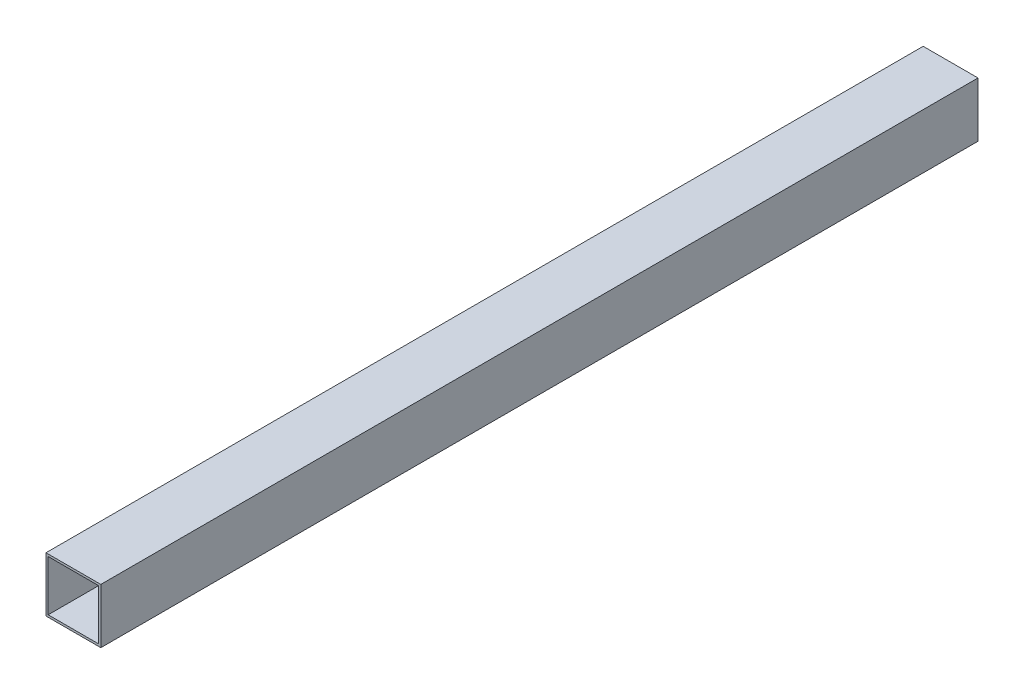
SolidWorks part; units mm, degrees
ref_plane "Piano frontale" through (0, 0, 0) normal (0, 0, 1) x (1, 0, 0)
ref_plane "Piano superiore" through (0, 0, 0) normal (0, 1, 0) x (1, 0, 0)
ref_plane "Piano destro" through (0, 0, 0) normal (1, 0, 0) x (0, 0, -1)
sketch "Schizzo1" plane through (0, 0, 0) normal (0, 0, 1) x (1, 0, 0)
  line L1 (-25, -25) -> (25, -25)
  line L2 (-25, -25) -> (-25, 25)
  line L3 (-25, 25) -> (25, 25)
  line L4 (25, -25) -> (25, 25)
  line L5 (-25, -25) -> (25, 25) construction
  line L6 (-25, 25) -> (25, -25) construction
  point P0 (0, 0)
  dimension "D1" = 50
  dimension "D2" = 50
extrude "Estrusione-Sottile1" add sketch "Schizzo1" along normal blind 800 thin
